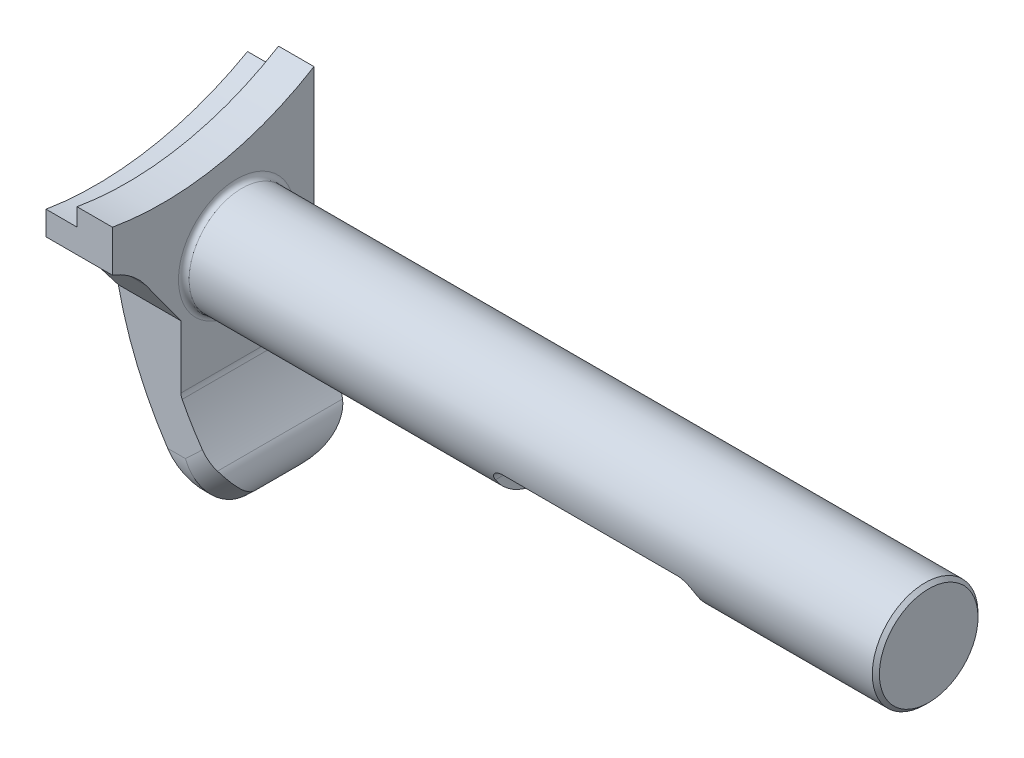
SolidWorks part; units mm, degrees
ref_plane "Front Plane" through (0, 0, 0) normal (0, 0, 1) x (1, 0, 0)
ref_plane "Top Plane" through (0, 0, 0) normal (0, 1, 0) x (1, 0, 0)
ref_plane "Right Plane" through (0, 0, 0) normal (1, 0, 0) x (0, 0, -1)
sketch "Sketch2" plane through (0, 0, 0) normal (0, 0, 1) x (1, 0, 0)
  line L0 (0, 11.6153) -> (0, 0) construction
  line L1 (4.759, 0) -> (58.0166, 0) construction
  line L2 (54.3052, 0) -> (54.3052, 3.5306)
  line L3 (54.0512, 3.7846) -> (4.759, 3.7846)
  line L4 (4.759, 3.7846) -> (4.759, -3.3846)
  line L5 (4.759, 0) -> (54.3052, 0)
  line L6 (54.3052, 3.5306) -> (54.0512, 3.7846)
  point P5 (54.3052, 3.7846)
  dimension "D1" = 7.5692
  dimension "D2" = 54.3052
revolve "Revolve1" add sketch "Sketch2" angle 360 about L1
sketch "Sketch3" plane through (0, 0, 0) normal (0, 0, 1) x (1, 0, 0)
  line L0 (4.759, -3.7846) -> (54.0512, -3.7846) construction
  line L1 (26.476, -3.7846) -> (40.954, -3.7846)
  line L2 (26.476, -3.7846) -> (26.476, -2.032)
  line L3 (27.492, -1.016) -> (39.938, -1.016)
  line L4 (40.954, -3.7846) -> (40.954, -2.032)
  line L5 (4.759, 3.7846) -> (4.759, -3.3846) construction
  line L6 (4.759, 0) -> (54.3052, 0) construction
  arc A0 (39.938, -1.016) -> (40.954, -2.032) centre (39.938, -2.032) cw
  arc A1 (26.476, -2.032) -> (27.492, -1.016) centre (27.492, -2.032) cw
  dimension "D4" = 1.016
  dimension "D1" = 36.195
  dimension "D2" = 14.478
  dimension "D3" = 1.016
extrude "Cut-Extrude1" cut sketch "Sketch3" against normal through all both and the other way through all
sketch "Sketch5" plane through (0, 0, 0) normal (0, 0, 1) x (1, 0, 0)
  line L0 (4.759, 11.2733) -> (4.759, -7.112)
  line L1 (4.759, 0) -> (54.3052, 0) construction
  line L2 (4.759, -7.112) -> (7.9197, -7.112) construction
  line L3 (4.759, 11.2733) -> (0.127, 11.2733)
  line L4 (0, 11.6153) -> (0, 0) construction
  line L5 (0, 11.1463) -> (0, -1.1043)
  line L6 (6.3444, -14.1925) -> (6.8941, -13.6726)
  arc A0 (4.759, -7.112) -> (4.8443, -7.4622) centre (5.521, -7.112) ccw
  arc A1 (0, -1.1043) -> (6.3444, -14.1925) centre (23.876, 2.3876) ccw
  arc A2 (4.8443, -7.4622) -> (7.0896, -10.9332) centre (23.876, 2.3876) ccw
  arc A3 (6.8941, -13.6726) -> (7.0896, -10.9332) centre (5.4979, -12.1963) ccw
  arc A4 (0.127, 11.2733) -> (0, 11.1463) centre (0.127, 11.1463) ccw
  point P21 (0, 11.2733)
  dimension "D2" = 0.762
  dimension "D3" = 24.13
  dimension "D6" = 2.032
  dimension "D7" = 0.127
  dimension "D1" = 7.112
  dimension "D4" = 2.3876
  dimension "D5" = 23.876
extrude "Boss-Extrude2" add sketch "Sketch5" along normal mid plane 17.78 contours L3 A4 L5 A1 L6 A3 A2 A0 L0
sketch "Sketch6" plane through (0, 0, 0) normal (-1, 0, 0) x (0, 0, 1)
  line L0 (0, 11.4389) -> (0, -14.1925) construction
  line L1 (8.89, -14.1925) -> (-8.89, -14.1925) construction
  line L2 (-9.324, 0) -> (3.9878, 0) construction
  line L3 (3.9878, -2.6353) -> (6.5022, 0.8254)
  line L4 (-5.5372, 8.364) -> (-5.5372, -11.0175)
  line L5 (-10.4464, 19.2592) -> (12.4856, 19.2592)
  line L6 (-10.4464, 19.2592) -> (-10.4464, -15.9251)
  line L7 (-10.4464, -15.9251) -> (12.4856, -15.9251)
  line L8 (12.4856, 19.2592) -> (12.4856, -15.9251)
  line L10 (0.8128, -14.1925) -> (-2.3622, -14.1925)
  line L11 (8.89, 5.6196) -> (8.89, 2.6416)
  line L12 (-9.324, -2.2352) -> (18.0458, -2.2352) construction
  line L13 (-9.324, -2.2352) -> (8.89, -2.2352) construction
  line L14 (3.9878, -2.6353) -> (3.9878, -11.0175)
  line L16 (-9.324, 0) -> (8.89, 0) construction
  arc A0 (-5.5372, 8.364) -> (8.89, 5.6196) centre (5.3086, 26.0858) ccw
  arc A2 (6.5022, 0.8254) -> (8.89, 2.6416) centre (10.7147, -2.2352) cw
  arc A3 (3.9878, -11.0175) -> (0.8128, -14.1925) centre (0.8128, -11.0175) cw
  arc A4 (-2.3622, -14.1925) -> (-5.5372, -11.0175) centre (-2.3622, -11.0175) cw
  point P27 (3.9878, -14.1925)
  point P30 (-5.5372, -14.1925)
  point P31 (5.3086, 26.0858)
  point P32 (0, 0)
  dimension "D1" = 20.7772
  dimension "D8" = 4.7752
  dimension "D10" = 5.207
  dimension "D11" = 3.175
  dimension "D2" = 26.0858
  dimension "D3" = 5.3086
  dimension "D4" = 5.5372
  dimension "D6" = 8.89
  dimension "D9" = 36
  dimension "D5" = 9.525
  dimension "D7" = 2.2352
extrude "Cut-Extrude2" cut sketch "Sketch6" against normal blind 17.78
fillet "Fillet1" radius 0.381 1 edges at (4.759, -3.7846, 0)
fillet "Fillet3" radius 3.175 3 edges at (7.5285, -12.1229, -5.3386) (6.4848, -14.0598, -3.2706) (7.1218, -10.9749, -5.5372)
fillet "Fillet4" radius 3.175 3 edges at (7.5127, -12.4595, 3.6414) (7.1218, -10.9749, 3.9878) (6.4848, -14.0598, 1.7212)
sketch "Sketch7" plane through (0, 0, 0) normal (-1, 0, 0) x (0, 0, 1)
  line L1 (-5.5372, 8.364) -> (-5.5372, -1.1043) construction
  line L2 (8.89, 4.3572) -> (8.89, 5.6196)
  line L3 (-5.5372, 8.364) -> (-5.5372, 6.92)
  arc A1 (-5.5372, 8.364) -> (8.89, 5.6196) centre (5.3086, 26.0858) ccw construction
  arc A2 (-6.1869, 7.3025) -> (9.1045, 4.3936) centre (5.3086, 26.0858) ccw
  arc A3 (-5.5372, 6.92) -> (8.89, 4.3572) centre (5.3086, 26.0858) ccw
  arc A4 (-5.5372, 8.364) -> (8.89, 5.6196) centre (5.3086, 26.0858) ccw
  dimension "D1" = 1.2446
extrude "Cut-Extrude3" cut sketch "Sketch7" against normal offset from surface (2.219 mm away) 2.54
